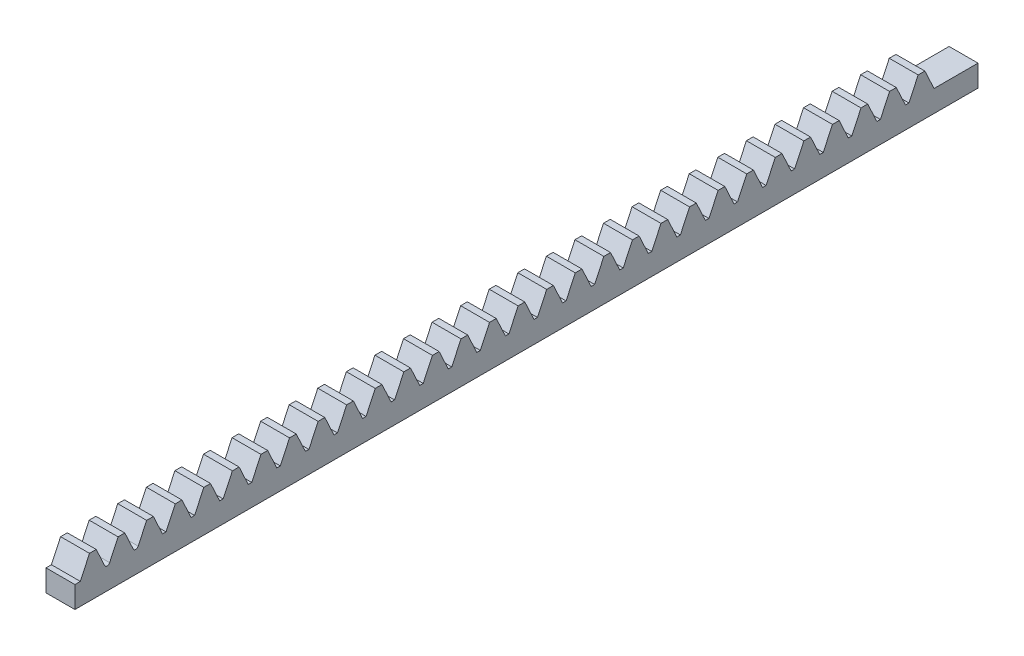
SolidWorks part; units mm, degrees
ref_plane "Front" through (0, 0, 0) normal (0, 0, 1) x (1, 0, 0)
ref_plane "Top" through (0, 0, 0) normal (0, 1, 0) x (1, 0, 0)
ref_plane "Right" through (0, 0, 0) normal (1, 0, 0) x (0, 0, -1)
sketch "Sketch4" plane through (0, 0, 0) normal (1, 0, 0) x (0, 0, -1)
  line L0 (8.44, 6) -> (9.41, 6)
  line L2 (0, 0) -> (250, 0)
  line L3 (0, 0) -> (0, 6)
  line L4 (0, 6) -> (1.5, 6)
  line L5 (250, 0) -> (250, 6)
  line L6 (1.5, 6) -> (4.04, 11.4579)
  line L7 (4.04, 11.4579) -> (5.9, 11.4579)
  line L8 (5.9, 11.4579) -> (8.44, 6)
  line L9 (4.97, 11.4579) -> (4.97, 6) construction
  line L10 (1.5, 6) -> (8.44, 6) construction
  line L11 (9.41, 6) -> (11.95, 11.4579)
  line L12 (11.95, 11.4579) -> (13.81, 11.4579)
  line L13 (13.81, 11.4579) -> (16.35, 6)
  line L14 (17.32, 6) -> (19.86, 11.4579)
  line L15 (19.86, 11.4579) -> (21.72, 11.4579)
  line L16 (21.72, 11.4579) -> (24.26, 6)
  line L17 (25.23, 6) -> (27.77, 11.4579)
  line L18 (27.77, 11.4579) -> (29.63, 11.4579)
  line L19 (29.63, 11.4579) -> (32.17, 6)
  line L20 (33.14, 6) -> (35.68, 11.4579)
  line L21 (35.68, 11.4579) -> (37.54, 11.4579)
  line L22 (37.54, 11.4579) -> (40.08, 6)
  line L23 (41.05, 6) -> (43.59, 11.4579)
  line L24 (43.59, 11.4579) -> (45.45, 11.4579)
  line L25 (45.45, 11.4579) -> (47.99, 6)
  line L26 (48.96, 6) -> (51.5, 11.4579)
  line L27 (51.5, 11.4579) -> (53.36, 11.4579)
  line L28 (53.36, 11.4579) -> (55.9, 6)
  line L29 (56.87, 6) -> (59.41, 11.4579)
  line L30 (59.41, 11.4579) -> (61.27, 11.4579)
  line L31 (61.27, 11.4579) -> (63.81, 6)
  line L32 (64.78, 6) -> (67.32, 11.4579)
  line L33 (67.32, 11.4579) -> (69.18, 11.4579)
  line L34 (69.18, 11.4579) -> (71.72, 6)
  line L35 (72.69, 6) -> (75.23, 11.4579)
  line L36 (75.23, 11.4579) -> (77.09, 11.4579)
  line L37 (77.09, 11.4579) -> (79.63, 6)
  line L38 (80.6, 6) -> (83.14, 11.4579)
  line L39 (83.14, 11.4579) -> (85, 11.4579)
  line L40 (85, 11.4579) -> (87.54, 6)
  line L41 (88.51, 6) -> (91.05, 11.4579)
  line L42 (91.05, 11.4579) -> (92.91, 11.4579)
  line L43 (92.91, 11.4579) -> (95.45, 6)
  line L44 (96.42, 6) -> (98.96, 11.4579)
  line L45 (98.96, 11.4579) -> (100.82, 11.4579)
  line L46 (100.82, 11.4579) -> (103.36, 6)
  line L47 (104.33, 6) -> (106.87, 11.4579)
  line L48 (106.87, 11.4579) -> (108.73, 11.4579)
  line L49 (108.73, 11.4579) -> (111.27, 6)
  line L50 (112.24, 6) -> (114.78, 11.4579)
  line L51 (114.78, 11.4579) -> (116.64, 11.4579)
  line L52 (116.64, 11.4579) -> (119.18, 6)
  line L53 (120.15, 6) -> (122.69, 11.4579)
  line L54 (122.69, 11.4579) -> (124.55, 11.4579)
  line L55 (124.55, 11.4579) -> (127.09, 6)
  line L56 (128.06, 6) -> (130.6, 11.4579)
  line L57 (130.6, 11.4579) -> (132.46, 11.4579)
  line L58 (132.46, 11.4579) -> (135, 6)
  line L59 (135.97, 6) -> (138.51, 11.4579)
  line L60 (138.51, 11.4579) -> (140.37, 11.4579)
  line L61 (140.37, 11.4579) -> (142.91, 6)
  line L62 (143.88, 6) -> (146.42, 11.4579)
  line L63 (146.42, 11.4579) -> (148.28, 11.4579)
  line L64 (148.28, 11.4579) -> (150.82, 6)
  line L65 (151.79, 6) -> (154.33, 11.4579)
  line L66 (154.33, 11.4579) -> (156.19, 11.4579)
  line L67 (156.19, 11.4579) -> (158.73, 6)
  line L68 (159.7, 6) -> (162.24, 11.4579)
  line L69 (162.24, 11.4579) -> (164.1, 11.4579)
  line L70 (164.1, 11.4579) -> (166.64, 6)
  line L71 (167.61, 6) -> (170.15, 11.4579)
  line L72 (170.15, 11.4579) -> (172.01, 11.4579)
  line L73 (172.01, 11.4579) -> (174.55, 6)
  line L74 (175.52, 6) -> (178.06, 11.4579)
  line L75 (178.06, 11.4579) -> (179.92, 11.4579)
  line L76 (179.92, 11.4579) -> (182.46, 6)
  line L77 (183.43, 6) -> (185.97, 11.4579)
  line L78 (185.97, 11.4579) -> (187.83, 11.4579)
  line L79 (187.83, 11.4579) -> (190.37, 6)
  line L80 (191.34, 6) -> (193.88, 11.4579)
  line L81 (193.88, 11.4579) -> (195.74, 11.4579)
  line L82 (195.74, 11.4579) -> (198.28, 6)
  line L83 (199.25, 6) -> (201.79, 11.4579)
  line L84 (201.79, 11.4579) -> (203.65, 11.4579)
  line L85 (203.65, 11.4579) -> (206.19, 6)
  line L86 (207.16, 6) -> (209.7, 11.4579)
  line L87 (209.7, 11.4579) -> (211.56, 11.4579)
  line L88 (211.56, 11.4579) -> (214.1, 6)
  line L89 (215.07, 6) -> (217.61, 11.4579)
  line L90 (217.61, 11.4579) -> (219.47, 11.4579)
  line L91 (219.47, 11.4579) -> (222.01, 6)
  line L92 (222.98, 6) -> (225.52, 11.4579)
  line L93 (225.52, 11.4579) -> (227.38, 11.4579)
  line L94 (227.38, 11.4579) -> (229.92, 6)
  line L95 (230.89, 6) -> (233.43, 11.4579)
  line L96 (233.43, 11.4579) -> (235.29, 11.4579)
  line L97 (235.29, 11.4579) -> (237.83, 6)
  line L98 (16.35, 6) -> (17.32, 6)
  line L99 (24.26, 6) -> (25.23, 6)
  line L100 (32.17, 6) -> (33.14, 6)
  line L101 (40.08, 6) -> (41.05, 6)
  line L102 (47.99, 6) -> (48.96, 6)
  line L103 (55.9, 6) -> (56.87, 6)
  line L104 (63.81, 6) -> (64.78, 6)
  line L105 (71.72, 6) -> (72.69, 6)
  line L106 (79.63, 6) -> (80.6, 6)
  line L107 (87.54, 6) -> (88.51, 6)
  line L108 (95.45, 6) -> (96.42, 6)
  line L109 (103.36, 6) -> (104.33, 6)
  line L110 (111.27, 6) -> (112.24, 6)
  line L111 (119.18, 6) -> (120.15, 6)
  line L112 (127.09, 6) -> (128.06, 6)
  line L113 (135, 6) -> (135.97, 6)
  line L114 (142.91, 6) -> (143.88, 6)
  line L115 (150.82, 6) -> (151.79, 6)
  line L116 (158.73, 6) -> (159.7, 6)
  line L117 (166.64, 6) -> (167.61, 6)
  line L118 (174.55, 6) -> (175.52, 6)
  line L119 (182.46, 6) -> (183.43, 6)
  line L120 (190.37, 6) -> (191.34, 6)
  line L121 (198.28, 6) -> (199.25, 6)
  line L122 (206.19, 6) -> (207.16, 6)
  line L123 (214.1, 6) -> (215.07, 6)
  line L124 (222.01, 6) -> (222.98, 6)
  line L125 (229.92, 6) -> (230.89, 6)
  line L126 (237.83, 6) -> (250, 6)
  dimension "D1" = 1.86
  dimension "D2" = 6.02
  dimension "D3" = 6.94
  dimension "D4" = 250
  dimension "D5" = 6
  dimension "D6" = 1.5
extrude "Extrude1" add sketch "Sketch4" along normal blind 8
scale "Scale2" scale about centroid uniform scaling yes scale factor 0.25
fillet "Fillet1" radius 0.1902 4 edges at (3, 5.0163, -94.683) (4, 5.0163, -94.5618) (4, 5.0163, -94.8043) (5, 5.0163, -94.683)
fillet "Fillet2" radius 0.1902 4 edges at (3, 5.0163, -96.6605) (4, 5.0163, -96.5393) (4, 5.0163, -96.7818) (5, 5.0163, -96.6605)
equation "\"Pd\"= 16 ' \"diametral pitch\""
equation "\"N\"= 18 ' Number of \"teeth\""
equation "\"a\"=1/\"Pd\" ' Addendum"
equation "\"d\"= \"N\"/\"Pd\" ' \"Pitch diameter\""
equation "\"phi\"= 20*pi/180 "
equation "\"b\"= 1.25 / \"Pd\" ' \"Dedendum\""
equation "\"br\"=\"d\"/2-\"b\" 'Base Circle Radius"
equation "\"working depth\"= 2 / \"Pd\""
equation "\"Whole depth\"= 2.25 / \"Pd\""
equation "\"Circular tooth thickness\"= 1.571 /\"Pd\""
equation "\"Fillet radius\"= .3 / \"Pd\""
equation "\"minimum basic clearance\"= .25 /\"Pd\""
equation "\"minimum width of top land\"= .25 / \"Pd\""
equation "\"Involute Length 1@Sketch1\" = \"Involute Angle 5@Sketch1\"*\"D1@Sketch1\""
equation "\"Involute Length 2@Sketch1\"=\"Involute Angle 2@Sketch1\"*\"D1@Sketch1\""
equation "\"Involute Length 3@Sketch1\"=\"Involute Angle 3@Sketch1\"*\"D1@Sketch1\""
equation "\"Involute Length 4@Sketch1\"=\"Involute Angle 4@Sketch1\"*\"D1@Sketch1\""
equation "\"Involute Length 6@Sketch1\"=\"Involute Angle 6@Sketch1\"*\"D1@Sketch1\""
equation "\"pressure angle@Sketch1\" = \"phi\""
equation "\"Pitch diameter@Sketch1\" = \"d\""
equation "\"Dedendum@Sketch1\" = \"b\""
equation "\"Fillet Radius@Sketch1\"=\"Fillet radius\""
equation "\"measured circular tooth thickness\"= \"D17@Sketch1\"*\"D20@Sketch1\""
equation "\"Tooth Thickness Angle@Sketch1\"=\"Circular tooth thickness\"/(\"d\"/2)"
equation "\"Involute Crux Angle@Sketch1\"=\"D15@Sketch1\"/\"D1@Sketch1\""
equation "\"Involute Length 5@Sketch1\"=\"Involute Angle 5@Sketch1\"*\"D1@Sketch1\""
